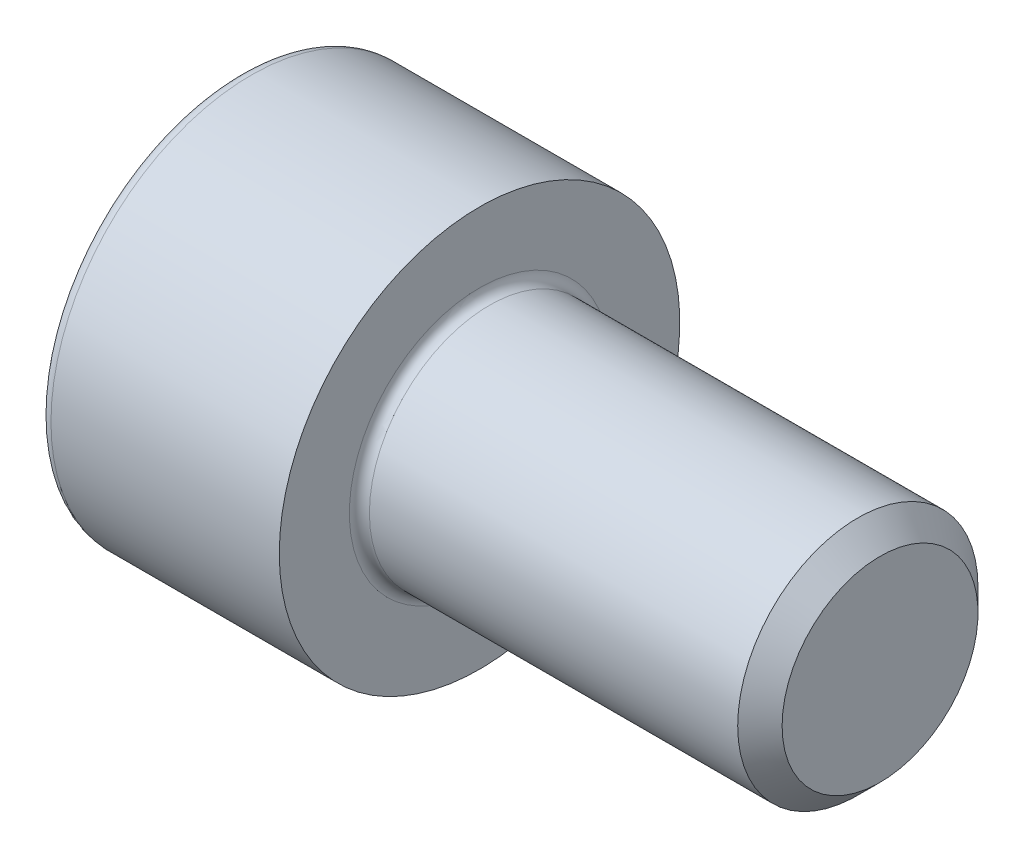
SolidWorks part; units mm, degrees
ref_plane "Plane1" through (0, 0, 0) normal (0, 0, 1) x (1, 0, 0)
ref_plane "Plane2" through (0, 0, 0) normal (0, 1, 0) x (1, 0, 0)
ref_plane "Plane3" through (0, 0, 0) normal (1, 0, 0) x (0, 0, -1)
sketch "BodySke" plane through (0, 0, 0) normal (0, 0, 1) x (1, 0, 0)
  line L0 (0, 0) -> (0, 5)
  line L1 (0, 5) -> (6, 5)
  line L2 (6, 5) -> (6, 3)
  line L3 (6, 3) -> (15.4455, 3)
  line L4 (16, 2.4455) -> (16, 0)
  line L5 (16, 0) -> (0, 0)
  line L6 (-31.75, 0) -> (127, 0) construction
  line L8 (16, 2.4455) -> (15.4455, 3)
  line L10 (16, -2.4455) -> (15.4455, -3) construction
  line L11 (7, 9.525) -> (7, 3.175) construction
  line L12 (6, 9.525) -> (6, 3.175) construction
  line L13 (-44, 9.525) -> (-44, 3.175) construction
  dimension "Diameter" = 6
  dimension "Head_ht" = 6
  dimension "Length" = 10
  dimension "Body_ch_ang" = 45
  dimension "Head_dia" = 10
  dimension "Minor_dia" = 4.891
  dimension "Advance" = 1
  dimension "Thread_nom" = 10
  dimension "Thread_length" = 60
revolve "Base-Revolve" add sketch "BodySke"
fillet "Fillet1" radius 0.25 1 edges at (6, 0, 3)
fillet "Fillet2" radius 0.3 1 edges at (0, 0, 5)
sketch "Sketch2" plane through (0, 0, 0) normal (0, 0, 1) x (1, 0, 0)
  line L0 (0, 2.542) -> (3, 2.542)
  line L1 (3, 2.542) -> (4.4676, 0)
  line L2 (-31.75, 0) -> (127, 0) construction
  line L3 (4.4676, 0) -> (0, 0)
  line L4 (0, 0) -> (0, 2.542)
  line L6 (0, 0) -> (47.625, 0) construction
  dimension "D1" = 2.542
  dimension "D2" = 60
  dimension "Depth" = 3
revolve "Hex-PreBroach" cut sketch "Sketch2" angle 360 about L6
sketch "Sketch3" plane through (0, 0, 0) normal (-1, 0, 0) x (0, 0.5, 0.866)
  line L0 (1.4676, 2.542) -> (-1.4676, 2.542)
  line L1 (-1.4676, 2.542) -> (-2.9352, 0)
  line L2 (1.4676, 2.542) -> (2.9352, 0)
  line L3 (1.4676, -2.542) -> (2.9352, 0)
  line L4 (1.4676, -2.542) -> (-1.4676, -2.542)
  line L5 (-1.4676, -2.542) -> (-2.9352, 0)
  dimension "D1" = 2.542
  dimension "D2" = 2.542
  dimension "Hex_size" = 5.084
extrude "Hex" cut sketch "Sketch3" against normal blind 3
sketch "ThdSchSke" plane through (0, 0, 0) normal (0, 0, 1) x (1, 0, 0)
  line L0 (9, -2.4455) -> (8.6117, -3)
  line L1 (9, -2.4455) -> (9.3883, -3)
  line L2 (9.3883, -3) -> (9.3883, -3.75)
  line L3 (-3.175, 0) -> (5.1513, 0) construction
  line L4 (0, 4.7) -> (0, -4.7) construction
  line L5 (9.3883, -3.75) -> (8.6117, -3.75)
  line L6 (8.6117, -3.75) -> (8.6117, -3)
  dimension "Thread_minor" = 4.891
  dimension "Diameter" = 6
  dimension "Start" = 9
  dimension "SideAngle" = 55
  dimension "VeeAngle" = 70
  dimension "Overcut" = 7.5
revolve "ThreadSchematic" [suppressed] cut sketch "ThdSchSke" angle 360 about L3
pattern_linear "ThdSchPat" [suppressed]
equation "\"D2@Sketch3\" = \"Hex_size@Sketch3\" / 2"
equation "\"D1@Sketch3\" = \"Hex_size@Sketch3\" / 2"
equation "\"D1@Sketch2\" = \"Hex_size@Sketch3\" / 2"
equation "\"Thread_minor@ThreadCosmetic\"  =  \"Minor_dia@BodySke\""
equation "\"Depth@Sketch2\" =  \"Key_eng@Hex\""
equation "\"Thread_length@ThreadCosmetic\" = ((sgn( (\"Length@BodySke\" - \"Advance@BodySke\" * 3.0) - \"Thread_nom@BodySke\" )-1)*( (\"Length@BodySke\" - \"Advance@BodySke\" * 3.0) - \"Thread_nom@BodySke\" ))/-2+ \"Thread_no"
equation "\"Thread_minor@ThdSchSke\" = \"Minor_dia@BodySke\""
equation "\"Diameter@ThdSchSke\" = \"Diameter@BodySke\""
equation "\"Overcut@ThdSchSke\" = \"Diameter@BodySke\" * 1.25"
equation "\"Start@ThdSchSke\" = \"Head_ht@BodySke\" + \"Length@BodySke\" - \"Thread_length@ThreadCosmetic\"  '---Non-countersunk---"
equation "\"Num_threads@ThdSchPat\" = int( \"Thread_length@ThreadCosmetic\" / \"Advance@BodySke\" + 0.999 )  + 1"
equation "\"Advance@ThdSchPat\" = \"Thread_length@ThreadCosmetic\" /  (\"Num_threads@ThdSchPat\" - 1) 'relax it"
equation "\"Num_threads@ThdSchPat\" = \"Num_threads@ThdSchPat\" - sgn( \"Num_threads@ThdSchPat\" - 1) '---chamfered tips only---"
